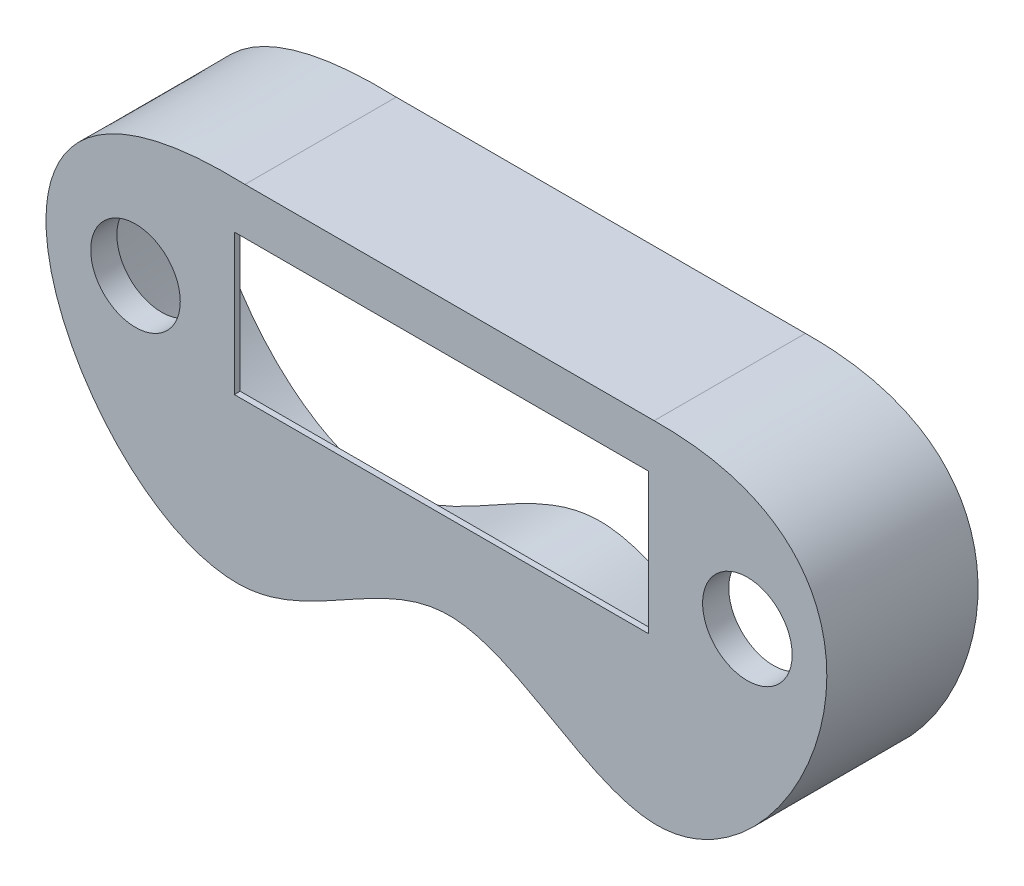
SolidWorks part; units mm, degrees
ref_plane "Plan de face" through (0, 0, 0) normal (0, 0, 1) x (1, 0, 0)
ref_plane "Plan de dessus" through (0, 0, 0) normal (0, 1, 0) x (1, 0, 0)
ref_plane "Plan de droite" through (0, 0, 0) normal (1, 0, 0) x (0, 0, -1)
sketch "Esquisse1" plane through (0, 0, 0) normal (0, 0, 1) x (1, 0, 0)
  line L0 (70, 60) -> (70, 0) construction
  line L1 (0, 0) -> (140, 0) construction
  line L2 (0, 0) -> (0, 60) construction
  line L3 (0, 60) -> (140, 60) construction
  line L4 (140, 0) -> (140, 60) construction
  line L5 (34.6419, 60) -> (34.6419, 0) construction
  line L6 (34.6419, 60) -> (105, 60)
  line L7 (105, 60) -> (105, 0) construction
  line L8 (34.6245, 59) -> (105.0069, 59)
  line L9 (140, 30) -> (1.4205, 30) construction
  spline S0 degree 3 poles (34.6419, 60) (-25.3583, 62.0906) (19.3165, -29.1952) (69.7557, 26.1751) (119.4961, -28.3157) (156.2743, 60.7092) (105, 60) knots 0 0 0 0 0.360735 0.513078 0.664072 1 1 1 1
  spline S1 degree 1 poles (34.6245, 59) (105.0069, 59) knots 0 0 1 1 construction
  spline S2 degree 3 poles (105.0069, 59) (105.5835, 59.008) (106.752, 59.0081) (108.9667, 58.9431) (111.5931, 58.7443) (114.4961, 58.3279) (118.053, 57.5498) (121.9219, 56.1862) (125.6996, 54.0094) (128.6785, 51.3689) (131.6743, 47.3144) (133.7332, 41.374) (133.8163, 33.3385) (131.8062, 25.0072) (128.0498, 17.0121) (122.9193, 9.9783) (116.806, 4.5194) (111.246, 1.7797) (106.7202, 0.9228) (102.2048, 1.0533) (96.3781, 2.9819) (89.195, 6.8917) (83.1167, 10.3818) (78.1866, 12.6371) (74.4461, 13.8836) (70.6426, 14.5071) (66.8151, 14.275) (63.0709, 13.3269) (58.1481, 11.3738) (52.0934, 8.0627) (44.8966, 3.9987) (38.9496, 1.595) (34.2626, 0.8595) (29.5476, 1.0675) (23.6185, 2.943) (16.8449, 7.353) (10.8198, 13.4249) (5.9379, 20.6361) (2.5775, 28.4511) (1.0984, 36.3249) (1.8257, 43.7088) (4.5004, 49.0569) (8.0739, 52.6756) (11.5402, 55.0077) (15.857, 56.8925) (20.2109, 58.0288) (24.1735, 58.64) (27.3889, 58.9404) (30.2823, 59.0512) (32.7139, 59.0524) (33.9931, 59.022) (34.6245, 59) knots -0.000035 -0.000035 -0.000035 -0.000035 0.003872 0.007778 0.015591 0.023404 0.031217 0.046842 0.062468 0.078094 0.09372 0.124971 0.156223 0.187474 0.218726 0.249978 0.281229 0.312481 0.328107 0.343732 0.374984 0.406235 0.437487 0.453113 0.468739 0.484364 0.49999 0.515616 0.531242 0.562493 0.593745 0.624996 0.640622 0.656248 0.687499 0.718751 0.750003 0.781254 0.812506 0.843757 0.875009 0.90626 0.921886 0.937512 0.953138 0.968764 0.976576 0.984389 0.992202 0.996109 1.000015 1.000015 1.000015 1.000015
  spline S3 degree 1 poles (34.6071, 59.0006) (105.0138, 59.0001) knots 0 0 1 1 construction
  spline S4 degree 3 poles (34.6071, 59.0006) (33.976, 59.0226) (32.6975, 59.0525) (30.2666, 59.0509) (27.3744, 58.9394) (24.1601, 58.6384) (20.1992, 58.0264) (15.8471, 56.889) (11.5323, 55.0034) (8.0679, 52.6705) (4.4965, 49.0512) (1.824, 43.7024) (1.0988, 36.3182) (2.5796, 28.4446) (5.9412, 20.6303) (10.8237, 13.4201) (16.8492, 7.3494) (23.6228, 2.9409) (29.5517, 1.0668) (34.2664, 0.8597) (38.9532, 1.5962) (44.8999, 4.0004) (52.0964, 8.0644) (58.1508, 11.3752) (63.0734, 13.3277) (66.8175, 14.2754) (70.6448, 14.507) (74.4481, 13.8831) (78.1884, 12.6364) (83.1183, 10.3809) (89.1962, 6.891) (96.3789, 2.9816) (102.2053, 1.0532) (106.7204, 0.9229) (111.2461, 1.7798) (116.8058, 4.5192) (122.9188, 9.9778) (128.0492, 17.0111) (131.8056, 25.0057) (133.816, 33.3365) (133.7335, 41.3718) (131.6753, 47.3122) (128.6804, 51.3668) (125.7021, 54.0075) (121.9253, 56.1846) (118.0573, 57.5485) (114.5011, 58.327) (111.5986, 58.7437) (108.9728, 58.9427) (106.7585, 59.008) (105.5902, 59.0081) (105.0138, 59.0001) knots 0 0 0 0 0.003906 0.007812 0.015625 0.023438 0.03125 0.046875 0.0625 0.078125 0.09375 0.125 0.15625 0.1875 0.21875 0.25 0.28125 0.3125 0.34375 0.359375 0.375 0.40625 0.4375 0.46875 0.484375 0.5 0.515625 0.53125 0.546875 0.5625 0.59375 0.625 0.65625 0.671875 0.6875 0.71875 0.75 0.78125 0.8125 0.84375 0.875 0.90625 0.921875 0.9375 0.953125 0.96875 0.976562 0.984375 0.992188 0.996094 1 1 1 1
  dimension "D1" = 140
  dimension "D2" = 60
  dimension "D3" = 1
  dimension "D4" = 35
  dimension "D5" = 1
extrude "Boss.-Extru.6" add sketch "Esquisse1" along normal blind 25 contours L6 S0 L8 S2
sketch "Esquisse3" plane through (0, 0, 25) normal (0, 0, 1) x (1, 0, 0)
  line L1 (105, 60) -> (34.6419, 60)
  line L2 (105, 60) -> (34.6419, 60)
  spline S1 degree 3 poles (3016.7425, -2588.8993) (-184.008, 703.6077) (-43.4301, -98.0761) (69.7557, 26.1751) (182.679, -97.5329) (275.8594, 720.6608) (-2685.5885, -2789.255) knots -0.826108 -0.826108 -0.826108 -0.826108 0.360735 0.513078 0.664072 1.812028 1.812028 1.812028 1.812028 only from (34.6419, 60) to (105, 60)
  spline S2 degree 3 poles (34.6419, 60) (-25.3583, 62.0906) (19.3165, -29.1952) (69.7557, 26.1751) (119.4961, -28.3157) (156.2743, 60.7092) (105, 60) knots 0 0 0 0 0.360735 0.513078 0.664072 1 1 1 1
  dimension "D1" = 0
extrude "Boss.-Extru.7" add sketch "Esquisse3" along normal blind 1
sketch "Esquisse4" plane through (0, 0, 26) normal (0, 0, 1) x (1, 0, 0)
  line L0 (105, 60) -> (34.6419, 60) construction
  line L1 (32.821, 52) -> (104.021, 52)
  line L2 (32.821, 52) -> (32.821, 27.8)
  line L3 (32.821, 27.8) -> (104.021, 27.8)
  line L4 (104.021, 52) -> (104.021, 27.8)
  circle A0 centre (15.821, 37) radius 7.7
  circle A1 centre (121.021, 37) radius 7.7
  point P11 (69.821, 60)
  point P14 (69.821, 60)
  dimension "D3" = 15.4
  dimension "D4" = 15.4
  dimension "D1" = 71.2
  dimension "D2" = 24.2
  dimension "D5" = 17
  dimension "D6" = 17
  dimension "D7" = 15
  dimension "D8" = 15
  dimension "D9" = 37
  dimension "D10" = 8
extrude "Enlèv. mat.-Extru.2" cut sketch "Esquisse4" against normal blind 1
sketch "Esquisse5" plane through (0, 0, 25) normal (0, 0, -1) x (-1, 0, 0)
  circle A0 centre (-121.021, 37) radius 7.7
  circle A1 centre (-15.821, 37) radius 7.7
  circle A2 centre (-121.021, 37) radius 8.7
  circle A3 centre (-15.821, 37) radius 8.7
  dimension "D1" = 15.4
  dimension "D2" = 15.4
  dimension "D3" = 1
extrude "Boss.-Extru.8" add sketch "Esquisse5" along normal blind 3.5
